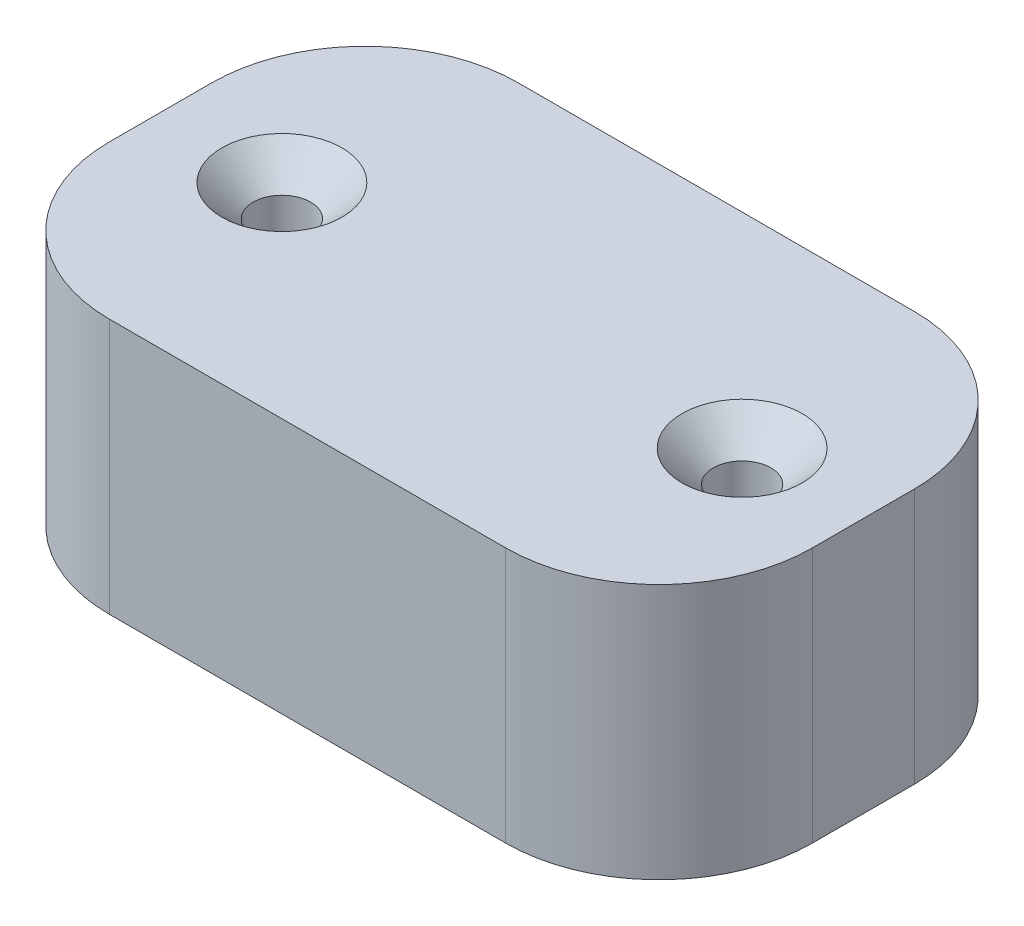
SolidWorks part; units mm, degrees
ref_plane "Front Plane" through (0, 0, 0) normal (0, 0, 1) x (1, 0, 0)
ref_plane "Top Plane" through (0, 0, 0) normal (0, 1, 0) x (1, 0, 0)
ref_plane "Right Plane" through (0, 0, 0) normal (1, 0, 0) x (0, 0, -1)
sketch "Sketch1" plane through (0, 0, 0) normal (0, 0, 1) x (1, 0, 0)
  line L1 (-27.5, 0) -> (27.5, 0)
  line L2 (-27.5, 0) -> (-27.5, 20)
  line L3 (-27.5, 20) -> (27.5, 20)
  line L4 (27.5, 0) -> (27.5, 20)
  dimension "D1" = 55
  dimension "D2" = 20
extrude "Boss-Extrude1" add sketch "Sketch1" along normal mid plane 32
fillet "Fillet1" radius 12 4 edges at (27.5, 10, 16) (27.5, 10, -16) (-27.5, 10, -16) (-27.5, 10, 16)
hole_wizard "CSK for M4 Flat Head Machine Screw1" positions "Sketch4" profile "Sketch3" countersink size "M4" standard "Ansi Metric"
sketch "Sketch4" plane through (0, 20, 0) normal (0, 1, 0) x (-1, 0, 0)
  point P0 (18, 0)
  dimension "D1" = 18
sketch "Sketch3" plane through (-18, 20, 0) normal (1, 0, 0) x (0, 0, 1)
  line L0 (0, 0) -> (0, 20)
  line L1 (0, 20) -> (2.25, 20)
  line L2 (2.25, 20) -> (2.25, 2.45)
  line L3 (2.25, 2.45) -> (4.7, 0)
  line L5 (4.7, 0) -> (0, 0)
  line L6 (-2.25, 2.45) -> (-4.7, 0) construction
  line L11 (0, -6.35) -> (0, 107.95) construction
  dimension "Thru Hole Dia." = 4.5
  dimension "Thru Hole Depth" = 20
  dimension "Near C'Sink Dia." = 9.4
  dimension "Near C'Sink Angle" = 90
mirror "Mirror1" about plane through (0, 0, 0) normal (1, 0, 0) of "CSK for M4 Flat Head Machine Screw1"
